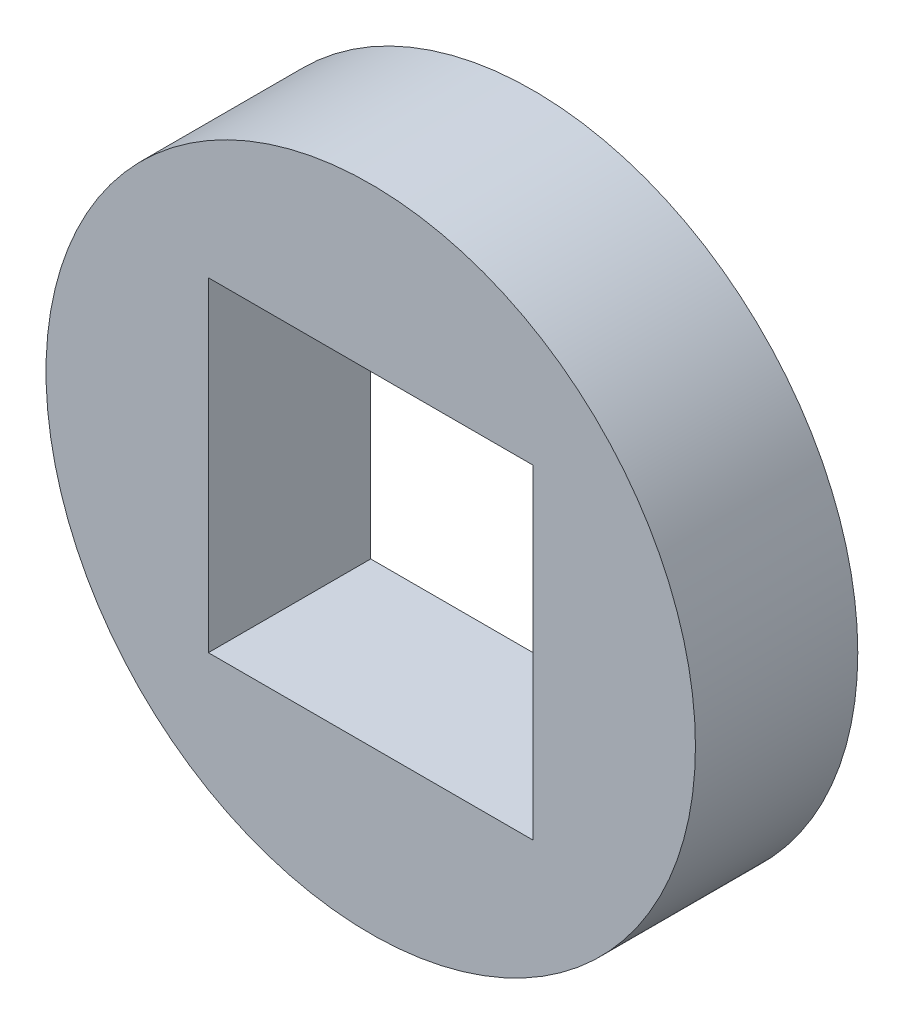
SolidWorks part; units mm, degrees
ref_plane "Front Plane" through (0, 0, 0) normal (0, 0, 1) x (1, 0, 0)
ref_plane "Top Plane" through (0, 0, 0) normal (0, 1, 0) x (1, 0, 0)
ref_plane "Right Plane" through (0, 0, 0) normal (1, 0, 0) x (0, 0, -1)
sketch "Sketch1" plane through (0, 0, 0) normal (0, 0, 1) x (1, 0, 0)
  line L1 (-3.175, 3.175) -> (3.175, 3.175)
  line L2 (-3.175, 3.175) -> (-3.175, -3.175)
  line L3 (-3.175, -3.175) -> (3.175, -3.175)
  line L4 (3.175, 3.175) -> (3.175, -3.175)
  line L5 (-3.175, 3.175) -> (3.175, -3.175) construction
  line L6 (-3.175, -3.175) -> (3.175, 3.175) construction
  circle A0 centre (0, 0) radius 6.35
  dimension "D1" = 12.7
  dimension "D2" = 6.35
  dimension "D3" = 6.35
extrude "Boss-Extrude1" add sketch "Sketch1" along normal blind 3.175
